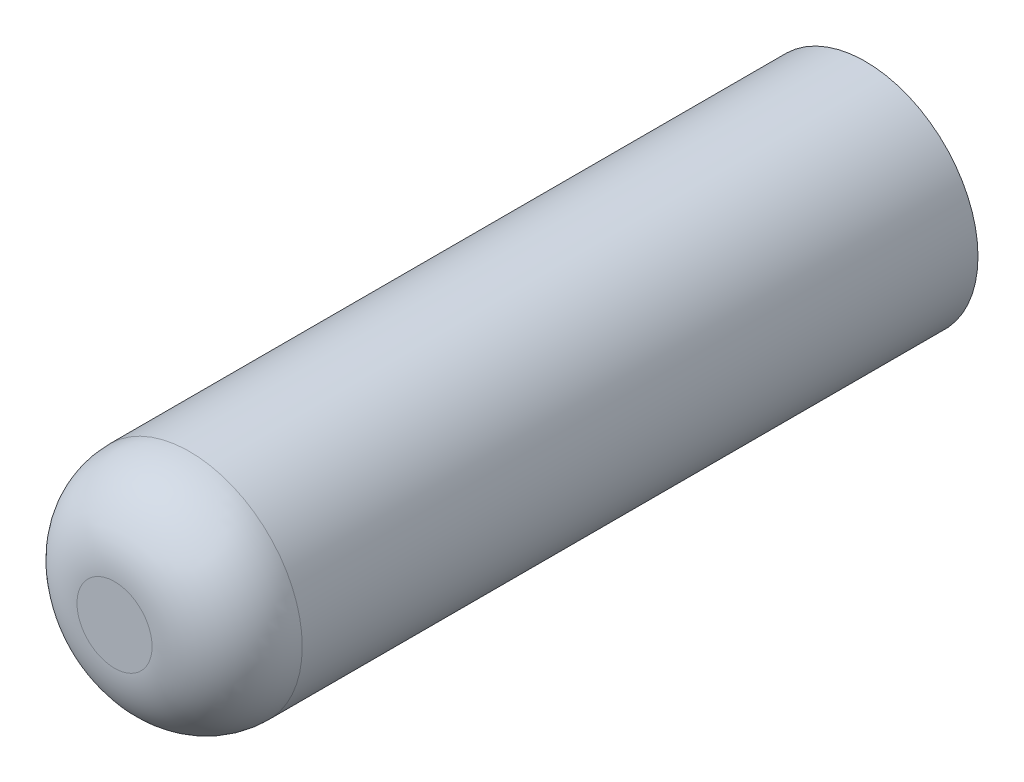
SolidWorks part; units mm, degrees
ref_plane "Front Plane" through (0, 0, 0) normal (0, 0, 1) x (1, 0, 0)
ref_plane "Top Plane" through (0, 0, 0) normal (0, 1, 0) x (1, 0, 0)
ref_plane "Right Plane" through (0, 0, 0) normal (1, 0, 0) x (0, 0, -1)
sketch "Sketch1" plane through (0, 0, 0) normal (0, 0, 1) x (1, 0, 0)
  circle A0 centre (0, 0) radius 3
  dimension "D1" = 6
extrude "Extrude1" add sketch "Sketch1" along normal blind 20
sketch "Sketch2" plane through (0, 0, 0) normal (0, 0, -1) x (-1, 0, 0)
  circle A0 centre (0, 0) radius 1.5
  dimension "D1" = 3
extrude "Extrude2" cut sketch "Sketch2" against normal blind 8.5
fillet "Fillet1" radius 2 1 edges at (3, 0, 20)
